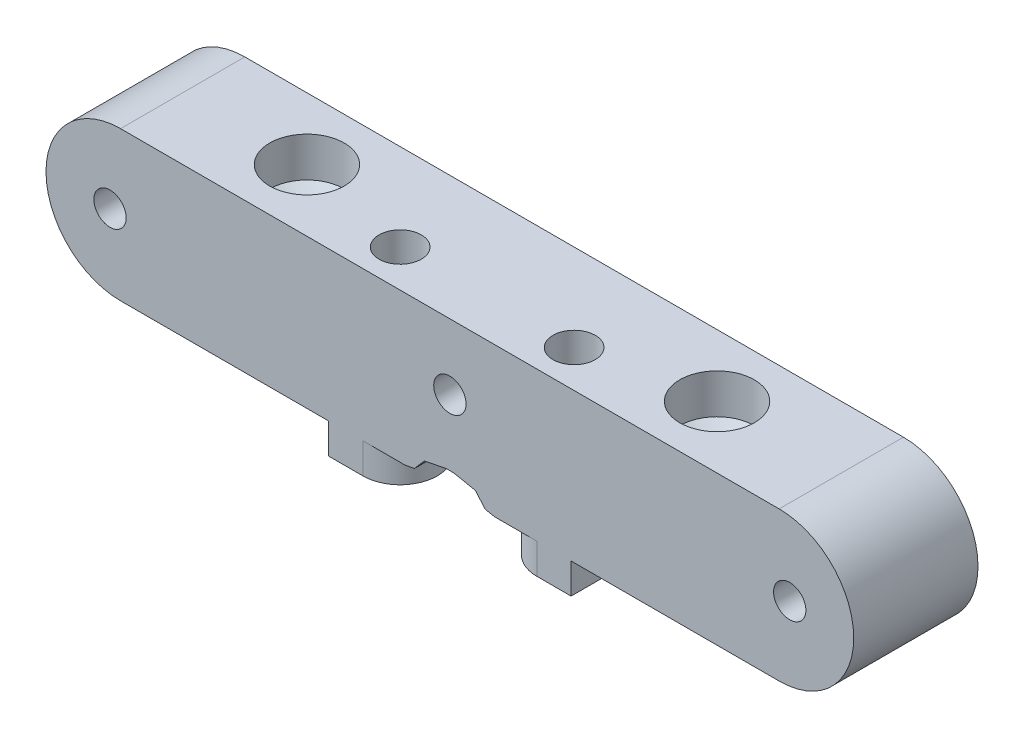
SolidWorks part; units mm, degrees
ref_plane "Płaszczyzna przednia" through (0, 0, 0) normal (0, 0, 1) x (1, 0, 0)
ref_plane "Płaszczyzna górna" through (0, 0, 0) normal (0, 1, 0) x (1, 0, 0)
ref_plane "Płaszczyzna prawa" through (0, 0, 0) normal (1, 0, 0) x (0, 0, -1)
sketch3d "Szkic 3D1"
  line L18 (6.8442, 55.1653, -29.05) -> (6.8442, 55.1653, -10)
  line L19 (6.8442, 55.1653, -10) -> (-3.5, 55.1653, -10)
  line L20 (-3.5, 55.1653, -10) -> (-3.5, 55.1653, 0)
  line L21 (-3.5, 55.1653, 0) -> (8.8442, 55.1653, 0)
  line L22 (8.8442, 55.1653, 0) -> (8.8442, 55.1653, -29.05)
  line L23 (8.8442, 55.1653, -29.05) -> (6.8442, 55.1653, -29.05)
  line L24 (29.1559, 55.1653, -29.05) -> (29.1559, 55.1653, 0)
  line L25 (29.1559, 55.1653, 0) -> (41.5001, 55.1653, 0)
  line L26 (41.5001, 55.1653, 0) -> (41.5001, 55.1653, -10)
  line L27 (41.5001, 55.1653, -10) -> (31.1559, 55.1653, -10)
  line L28 (31.1559, 55.1653, -10) -> (31.1559, 55.1653, -29.05)
  line L29 (31.1559, 55.1653, -29.05) -> (29.1559, 55.1653, -29.05)
  line L30 (29.0359, 79.6512, -6.988) -> (22, 81.5377, -6.988)
  line L31 (22, 81.5377, -6.988) -> (16, 81.5377, -6.988)
  line L32 (16, 81.5377, -6.988) -> (8.9641, 79.6512, -6.988)
  line L33 (8.9641, 71.9242, -6.988) -> (16, 70.0377, -6.988)
  line L34 (16, 70.0377, -6.988) -> (22, 70.0377, -6.988)
  line L35 (22, 70.0377, -6.988) -> (29.0359, 71.9242, -6.988)
  arc A9 (29.0359, 79.6512, -6.988) -> (29.0359, 71.9242, -6.988) centre (28, 75.7877, -6.988) ccw
  arc A10 (8.9641, 71.9242, -6.988) -> (8.9641, 79.6512, -6.988) centre (10, 75.7877, -6.988) ccw
  circle A11 centre (19, 70.4919, 0) radius 1.6
  circle A12 centre (34, 67.4414, 0) radius 2.35
  circle A13 centre (4, 67.4414, 0) radius 2.35
  circle A14 centre (2.5, 55.1653, -5) radius 2.3
  circle A15 centre (35.5001, 55.1653, -5) radius 2.3
  circle A16 centre (10, 75.7877, -6.988) radius 1.6
  circle A17 centre (28, 75.7877, -6.988) radius 1.6
  point P2 (28, 75.7877, -10.988)
  point P4 (10, 75.7877, -10.988)
  point P8 (19, 70.4919, -1.6)
  point P11 (34, 67.4414, -2.35)
  point P16 (4, 67.4414, -2.35)
  point P20 (2.5, 57.4653, -5)
  point P23 (35.5001, 57.4653, -5)
  point P30 (10, 75.7877, -8.588)
  point P36 (28, 75.7877, -8.588)
  dimension "D1" = 4.6
ref_plane "Płaszczyzna1" through (0, 55.1653, 0) normal (0, 1, 0) x (1, 0, 0)
sketch "Szkic2" plane through (0, 55.1653, 0) normal (0, 1, 0) x (1, 0, 0)
  line L1 (-3.5, 0) -> (41.5001, 0)
  line L2 (-3.5, 0) -> (-3.5, 10)
  line L3 (-3.5, 10) -> (41.5001, 10)
  line L4 (41.5001, 0) -> (41.5001, 10)
  circle A0 centre (35.5001, 5) radius 1.7
  circle A1 centre (2.5, 5) radius 1.7
  dimension "D1" = 3.4
extrude "Dodanie-wyciągnięcie1" add sketch "Szkic2" along normal blind 12
sketch "Szkic3" plane through (0, 67.1653, 0) normal (0, 1, 0) x (1, 0, 0)
  line L0 (41.5001, 0) -> (41.5001, 10) construction
  line L1 (-3.5, 0) -> (41.5001, 0)
  line L2 (-3.5, 0) -> (-3.5, 6.5)
  line L3 (-3.5, 6.5) -> (41.5001, 6.5)
  line L4 (41.5001, 0) -> (41.5001, 6.5)
  dimension "D1" = 6.5
extrude "Dodanie-wyciągnięcie2" add sketch "Szkic3" along normal blind 14.5
sketch "Szkic4" plane through (0, 0, -6.5) normal (0, 0, -1) x (-1, 0, 0)
  circle A0 centre (-28, 75.7877) radius 1.7
  circle A1 centre (-10, 75.7877) radius 1.7
  dimension "D1" = 3.4
extrude "Wytnij-wyciągnięcie1" cut sketch "Szkic4" against normal through all
sketch "Szkic5" plane through (0, 67.1653, 0) normal (0, -1, 0) x (1, 0, 0)
  line L1 (34.7001, -6.5) -> (36.3001, -6.5)
  line L2 (34.7001, -6.5) -> (36.3001, -6.5)
  line L3 (1.7, -6.5) -> (3.3, -6.5)
  line L4 (1.7, -6.5) -> (3.3, -6.5)
  arc A1 (36.3001, -6.5) -> (34.7001, -6.5) centre (35.5001, -5) ccw
  arc A2 (36.3001, -6.5) -> (34.7001, -6.5) centre (35.5001, -5) ccw
  arc A3 (3.3, -6.5) -> (1.7, -6.5) centre (2.5, -5) ccw
  arc A4 (3.3, -6.5) -> (1.7, -6.5) centre (2.5, -5) ccw
  dimension "D1" = 0
  dimension "D2" = 0
extrude "Wytnij-wyciągnięcie2" cut sketch "Szkic5" against normal through all
sketch "Szkic7" plane through (0, 0, -10) normal (0, 0, -1) x (-1, 0, 0)
  line L0 (-18.7005, 56.58) -> (-19.2996, 56.58)
  line L1 (-19.2996, 56.58) -> (-21.0498, 56.2301)
  line L2 (-21.0498, 56.2301) -> (-21.8427, 55.3159)
  line L3 (-21.8427, 55.3159) -> (-28.3862, 54.0065)
  line L4 (-28.3862, 54.0065) -> (-29.2559, 52.9456)
  line L5 (-29.2559, 52.9456) -> (-29.2559, 44.935)
  line L6 (-29.2559, 44.935) -> (-28.3862, 43.8741)
  line L7 (-28.3862, 43.8741) -> (-21.8427, 42.5647)
  line L8 (-21.8427, 42.5647) -> (-21.0498, 41.6505)
  line L9 (-21.0498, 41.6505) -> (-19.2996, 41.3006)
  line L10 (-19.2996, 41.3006) -> (-18.7005, 41.3006)
  line L11 (-18.7005, 41.3006) -> (-16.9503, 41.6505)
  line L12 (-16.9503, 41.6505) -> (-16.1574, 42.5647)
  line L13 (-16.1574, 42.5647) -> (-9.6138, 43.8741)
  line L14 (-9.6138, 43.8741) -> (-8.7442, 44.935)
  line L15 (-8.7442, 44.935) -> (-8.7442, 52.9456)
  line L16 (-8.7442, 52.9456) -> (-9.6138, 54.0065)
  line L17 (-9.6138, 54.0065) -> (-16.1574, 55.3159)
  line L18 (-16.1574, 55.3159) -> (-16.9503, 56.2301)
  line L19 (-16.9503, 56.2301) -> (-18.7005, 56.58)
  line L20 (-18.75, 56.08) -> (-19.2501, 56.08)
  line L21 (-19.2501, 56.08) -> (-20.7841, 55.7733)
  line L22 (-20.7841, 55.7733) -> (-21.5769, 54.8591)
  line L23 (-21.5769, 54.8591) -> (-28.1129, 53.5513)
  line L24 (-28.1129, 53.5513) -> (-28.7559, 52.7669)
  line L25 (-28.7559, 52.7669) -> (-28.7559, 45.1137)
  line L26 (-28.7559, 45.1137) -> (-28.1129, 44.3293)
  line L27 (-28.1129, 44.3293) -> (-21.5769, 43.0215)
  line L28 (-21.5769, 43.0215) -> (-20.7841, 42.1073)
  line L29 (-20.7841, 42.1073) -> (-19.2501, 41.8006)
  line L30 (-19.2501, 41.8006) -> (-18.7499, 41.8006)
  line L31 (-18.7499, 41.8006) -> (-17.216, 42.1073)
  line L32 (-17.216, 42.1073) -> (-16.4231, 43.0215)
  line L33 (-16.4231, 43.0215) -> (-9.8872, 44.3293)
  line L34 (-9.8872, 44.3293) -> (-9.2442, 45.1137)
  line L35 (-9.2442, 45.1137) -> (-9.2442, 52.7669)
  line L36 (-9.2442, 52.7669) -> (-9.8872, 53.5513)
  line L37 (-9.8872, 53.5513) -> (-16.4231, 54.8591)
  line L38 (-16.4231, 54.8591) -> (-17.216, 55.7733)
  line L39 (-17.216, 55.7733) -> (-18.75, 56.08)
  line L40 (-18.75, 56.08) -> (-19.2501, 56.08) construction
  line L41 (-19.2501, 56.08) -> (-20.7841, 55.7733) construction
  line L42 (-20.7841, 55.7733) -> (-21.5769, 54.8591) construction
  line L43 (-21.5769, 54.8591) -> (-28.1129, 53.5513) construction
  line L44 (-28.1129, 53.5513) -> (-28.7559, 52.7669) construction
  line L45 (-28.7559, 52.7669) -> (-28.7559, 45.1137) construction
  line L46 (-28.7559, 45.1137) -> (-28.1129, 44.3293) construction
  line L47 (-28.1129, 44.3293) -> (-21.5769, 43.0215) construction
  line L48 (-21.5769, 43.0215) -> (-20.7841, 42.1073) construction
  line L49 (-20.7841, 42.1073) -> (-19.2501, 41.8006) construction
  line L50 (-19.2501, 41.8006) -> (-18.7499, 41.8006) construction
  line L51 (-18.7499, 41.8006) -> (-17.216, 42.1073) construction
  line L52 (-17.216, 42.1073) -> (-16.4231, 43.0215) construction
  line L53 (-16.4231, 43.0215) -> (-9.8872, 44.3293) construction
  line L54 (-9.8872, 44.3293) -> (-9.2442, 45.1137) construction
  line L55 (-9.2442, 45.1137) -> (-9.2442, 52.7669) construction
  line L56 (-9.2442, 52.7669) -> (-9.8872, 53.5513) construction
  line L57 (-9.8872, 53.5513) -> (-16.4231, 54.8591) construction
  line L58 (-16.4231, 54.8591) -> (-17.216, 55.7733) construction
  line L59 (-17.216, 55.7733) -> (-18.75, 56.08) construction
  dimension "D1" = 0
  dimension "D2" = 0.5
extrude "Wytnij-wyciągnięcie3" cut sketch "Szkic7" against normal through all
sketch "Szkic11" plane through (0, 52.7669, 0) normal (0, 1, 0) x (1, 0, 0)
  line L0 (26, 0) -> (28.7559, 0) construction
  line L1 (28.7559, 0) -> (28.7559, 6) construction
  line L2 (28.7559, 6) -> (26, 6) construction
  line L3 (12, 6) -> (9.2442, 6) construction
  line L4 (9.2442, 6) -> (9.2442, 0) construction
  line L5 (9.2442, 0) -> (12, 0) construction
  line L6 (26, 0) -> (28.7559, 0)
  line L7 (28.7559, 0) -> (28.7559, 6)
  line L8 (28.7559, 6) -> (26, 6)
  line L9 (12, 6) -> (9.2442, 6)
  line L10 (9.2442, 6) -> (9.2442, 0)
  line L11 (9.2442, 0) -> (12, 0)
  arc A0 (26, 6) -> (26, 0) centre (26, 3) ccw construction
  arc A1 (12, 0) -> (12, 6) centre (12, 3) ccw construction
  arc A2 (26, 6) -> (26, 0) centre (26, 3) ccw
  arc A3 (12, 0) -> (12, 6) centre (12, 3) ccw
sketch "Szkic13" plane through (0, 55.1653, 0) normal (0, -1, 0) x (1, 0, 0)
  line L0 (28.7559, 0) -> (28.7559, -6) construction
  line L1 (26, 0) -> (28.7559, 0) construction
  line L2 (28.7559, -6) -> (26, -6) construction
  line L3 (12, -6) -> (9.2442, -6) construction
  line L4 (9.2442, 0) -> (12, 0) construction
  line L5 (9.2442, -6) -> (9.2442, 0) construction
  line L6 (28.7559, 0) -> (28.7559, -6)
  line L7 (26, 0) -> (28.7559, 0)
  line L8 (28.7559, -6) -> (26, -6)
  line L9 (12, -6) -> (9.2442, -6)
  line L10 (9.2442, 0) -> (12, 0)
  line L11 (9.2442, -6) -> (9.2442, 0)
  arc A0 (26, 0) -> (26, -6) centre (26, -3) ccw construction
  arc A1 (12, -6) -> (12, 0) centre (12, -3) ccw construction
  arc A2 (26, 0) -> (26, -6) centre (26, -3) ccw
  arc A3 (12, -6) -> (12, 0) centre (12, -3) ccw
extrude "Dodanie-wyciągnięcie4" add sketch "Szkic13" along normal blind 2.45
hole_wizard "Otwór Ø4.6 (4.6)1" positions "Szkic14" profile "Szkic15" hole size "Ø4.6" standard "DIN"
sketch "Szkic14" plane through (0, 0, 0) normal (0, 0, 1) x (1, 0, 0)
  point P0 (28, 75.7877)
  point P3 (10, 75.7877)
sketch "Szkic15" plane through (28, 75.7877, 0) normal (1, 0, 0) x (0, -1, 0)
  line L0 (0, 0) -> (0, 5.5)
  line L1 (0, 5.5) -> (2.3, 4.118)
  line L2 (2.3, 4.118) -> (2.3, 0)
  line L5 (2.3, 0) -> (0, 0)
  line L10 (0, 5.5) -> (-2.3, 4.118) construction
  line L11 (0, -6.35) -> (0, 107.95) construction
  dimension "Średnica otworu" = 4.6
  dimension "Głębokość otworu" = 5.5
  dimension "Kąt wiertła" = 118
sketch "Szkic16" plane through (0, 0, -6.5) normal (0, 0, -1) x (-1, 0, 0)
  line L0 (-16, 81.5377) -> (-8.9641, 79.6512) construction
  line L1 (-29.0359, 79.6512) -> (-22, 81.5377) construction
  line L2 (-16.4759, 81.6653) -> (-8.9641, 79.6512)
  line L3 (-29.0359, 79.6512) -> (-21.5241, 81.6653)
  line L5 (-34.7001, 81.6653) -> (-3.3, 81.6653) construction
  line L6 (-16.4759, 81.6653) -> (3.5, 81.6653)
  line L7 (-32, 75.7877) -> (-32, 67.1653)
  line L8 (-41.5001, 67.1653) -> (3.5, 67.1653) construction
  line L9 (-32, 67.1653) -> (-41.5001, 67.1653)
  line L10 (-41.5001, 67.1653) -> (-41.5001, 81.6653)
  line L11 (-41.5001, 81.6653) -> (-21.5241, 81.6653)
  line L12 (3.5, 81.6653) -> (3.5, 67.1653)
  line L13 (3.5, 67.1653) -> (-6, 67.1653)
  line L14 (-6, 67.1653) -> (-6, 75.7877)
  arc A0 (-8.9641, 71.9242) -> (-8.9641, 79.6512) centre (-10, 75.7877) ccw construction
  arc A1 (-29.0359, 79.6512) -> (-29.0359, 71.9242) centre (-28, 75.7877) ccw construction
  arc A2 (-6, 75.7877) -> (-8.9641, 79.6512) centre (-10, 75.7877) ccw
  arc A3 (-29.0359, 79.6512) -> (-32, 75.7877) centre (-28, 75.7877) ccw
extrude "Wytnij-wyciągnięcie4" cut sketch "Szkic16" against normal through all
sketch "Szkic17" plane through (0, 0, -6.5) normal (0, 0, -1) x (-1, 0, 0)
  line L6 (-8.9641, 79.6512) -> (-16.4759, 81.6653)
  line L7 (-16.4759, 81.6653) -> (-21.5241, 81.6653)
  line L8 (-21.5241, 81.6653) -> (-29.0359, 79.6512)
  line L9 (-32, 75.7877) -> (-32, 67.1653)
  line L10 (-32, 67.1653) -> (-6, 67.1653)
  line L11 (-6, 67.1653) -> (-6, 75.7877)
  line L12 (-8.9641, 79.6512) -> (-16.4759, 81.6653)
  line L13 (-16.4759, 81.6653) -> (-21.5241, 81.6653)
  line L14 (-21.5241, 81.6653) -> (-29.0359, 79.6512)
  line L15 (-32, 75.7877) -> (-32, 67.1653)
  line L16 (-32, 67.1653) -> (-6, 67.1653)
  line L17 (-6, 67.1653) -> (-6, 75.7877)
  arc A2 (-6, 75.7877) -> (-8.9641, 79.6512) centre (-10, 75.7877) ccw
  arc A3 (-29.0359, 79.6512) -> (-32, 75.7877) centre (-28, 75.7877) ccw
  arc A4 (-6, 75.7877) -> (-8.9641, 79.6512) centre (-10, 75.7877) ccw
  arc A5 (-29.0359, 79.6512) -> (-32, 75.7877) centre (-28, 75.7877) ccw
  dimension "D1" = 0
extrude "Wytnij-wyciągnięcie5" cut sketch "Szkic17" against normal through all
sketch "Szkic18" plane through (0, 52.7153, 0) normal (0, -1, 0) x (1, 0, 0)
  circle A0 centre (12, -3) radius 1.7
  circle A1 centre (26, -3) radius 1.7
  dimension "D1" = 3.4
extrude "Wytnij-wyciągnięcie6" cut sketch "Szkic18" against normal through all
hole_wizard "Otwór Ø6.0 (6)2" positions "Szkic21" profile "Szkic22" hole size "Ø6.0" standard "DIN"
sketch "Szkic21" plane through (0, 67.1653, 0) normal (0, 1, 0) x (1, 0, 0)
  point P0 (35.5001, 5)
  point P3 (2.5, 5)
sketch "Szkic22" plane through (35.5001, 67.1653, -5) normal (1, 0, 0) x (0, 0, 1)
  line L0 (0, 0) -> (0, 5)
  line L1 (0, 5) -> (3, 3.1974)
  line L2 (3, 3.1974) -> (3, 0)
  line L5 (3, 0) -> (0, 0)
  line L10 (0, 5) -> (-3, 3.1974) construction
  line L11 (0, -6.35) -> (0, 107.95) construction
  dimension "Średnica otworu" = 6
  dimension "Głębokość otworu" = 5
  dimension "Kąt wiertła" = 118
sketch "Szkic27" plane through (0, 0, -10) normal (0, 0, -1) x (-1, 0, 0)
  line L0 (-41.5001, 67.1653) -> (-41.5001, 55.1653) construction
  line L4 (-45.5001, 67.1653) -> (-41.5001, 67.1653)
  line L5 (-45.5001, 55.1653) -> (-41.5001, 55.1653)
  line L6 (-41.5001, 67.1653) -> (-41.5001, 55.1653)
  line L7 (3.5, 67.1653) -> (7.5, 67.1653)
  line L8 (3.5, 67.1653) -> (3.5, 55.1653)
  line L9 (3.5, 55.1653) -> (7.5, 55.1653)
  arc A0 (-45.5001, 67.1653) -> (-45.5001, 55.1653) centre (-45.5001, 61.1653) ccw
  arc A1 (7.5, 67.1653) -> (7.5, 55.1653) centre (7.5, 61.1653) cw
  dimension "D1" = 4
extrude "Dodanie-wyciągnięcie5" add sketch "Szkic27" against normal up to surface (10 mm away)
sketch "Szkic24" plane through (0, 0, -10) normal (0, 0, -1) x (-1, 0, 0)
  line L0 (-45.5001, 67.1653) -> (7.5, 67.1653) construction
  line L1 (-19, 67.1653) -> (-19, 56.58) construction
  line L2 (-18.7005, 56.58) -> (-19.2996, 56.58) construction
  line L3 (-46.3501, 61.1653) -> (8.35, 61.1653) construction
  circle A0 centre (-19, 61.8726) radius 1.3
  circle A1 centre (-46.3501, 61.1653) radius 2.35 construction
  arc A2 (-45.5001, 67.1653) -> (-45.5001, 55.1653) centre (-45.5001, 61.1653) ccw construction
  circle A3 centre (-46.3501, 61.1653) radius 1.3
  circle A4 centre (8.35, 61.1653) radius 1.3
  point P4 (-19, 67.1653)
  point P10 (-19, 61.8726)
  point P14 (-19, 61.1653)
  dimension "D1" = 2.6
  dimension "D2" = 4.7
  dimension "D3" = 2.8
extrude "Wytnij-wyciągnięcie8" cut sketch "Szkic24" against normal through all
hole_wizard "Otwór Ø4.6 (4.6)2" positions "Szkic25" profile "Szkic26" hole size "Ø4.6" standard "DIN"
sketch "Szkic25" plane through (0, 0, -10) normal (0, 0, -1) x (-1, 0, 0)
  point P0 (-19, 61.8726)
  point P4 (-46.3501, 61.1653)
  point P7 (8.35, 61.1653)
sketch "Szkic26" plane through (19, 61.8726, -10) normal (1, 0, 0) x (0, 1, 0)
  line L0 (0, 0) -> (0, 6)
  line L1 (0, 6) -> (2.3, 4.618)
  line L2 (2.3, 4.618) -> (2.3, 0)
  line L5 (2.3, 0) -> (0, 0)
  line L10 (0, 6) -> (-2.3, 4.618) construction
  line L11 (0, -6.35) -> (0, 107.95) construction
  dimension "Średnica otworu" = 4.6
  dimension "Głębokość otworu" = 6
  dimension "Kąt wiertła" = 118
